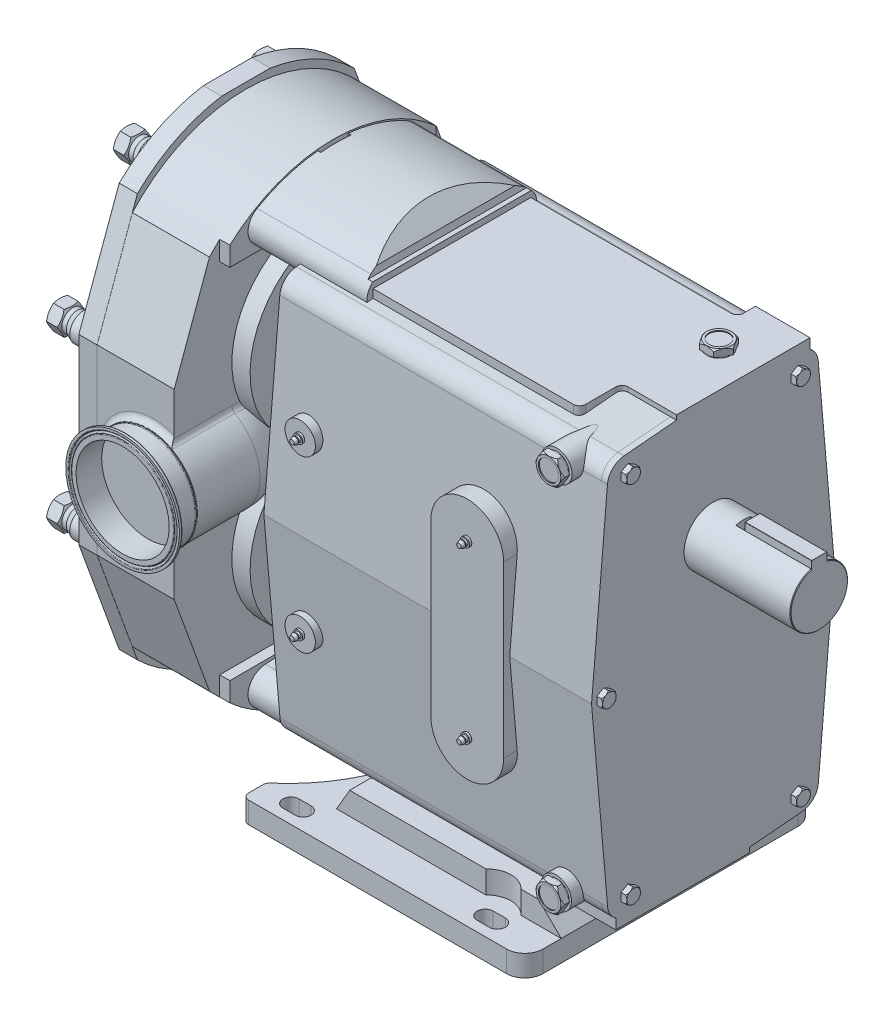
SolidWorks part; units mm, degrees
ref_plane "Front Plane" through (0, 0, 0) normal (0, 0, 1) x (1, 0, 0)
ref_plane "Top Plane" through (0, 0, 0) normal (0, 1, 0) x (1, 0, 0)
ref_plane "Right Plane" through (0, 0, 0) normal (1, 0, 0) x (0, 0, -1)
other "Join1"
other "108373<8>@210_U2_Upper Shaft"
other "108373<4>@210_U2_Upper Shaft"
other "108373<3>@210_U2_Upper Shaft"
other "108373<7>@210_U2_Upper Shaft"
other "108373<6>@210_U2_Upper Shaft"
other "grease fitting<4>@210_U2_Upper Shaft"
other "grease fitting<2>@210_U2_Upper Shaft"
other "cleanout plug<2>@210_U2_Upper Shaft"
other "oil plug<6>@210_U2_Upper Shaft"
other "oil plug<4>@210_U2_Upper Shaft"
other "108373<2>@210_U2_Upper Shaft"
other "Key_320<1>@210_U2_Upper Shaft"
other "Shaft_210<1>@210_U2_Upper Shaft"
other "new cover_gearcase_40669<1>@210_U2_Upper Shaft"
other "grease fitting<3>@210_U2_Upper Shaft"
other "grease fitting<1>@210_U2_Upper Shaft"
other "cleanout plug<1>@210_U2_Upper Shaft"
other "oil plug<5>@210_U2_Upper Shaft"
other "oil plug<3>@210_U2_Upper Shaft"
other "oil plug<2>@210_U2_Upper Shaft"
other "oil plug<1>@210_U2_Upper Shaft"
other "108373<5>@210_U2_Upper Shaft"
other "108373<1>@210_U2_Upper Shaft"
other "105406<1>@210_U2_Upper Shaft"
other "117523<1>@210_U2_Upper Shaft"
other "40288<1>@210_U2_Upper Shaft"
other "105478<1>@210_U2_Upper Shaft"
other "body_shim-210-320-370U2<2>@210_U2_Upper Shaft"
other "body_shim-210-320-370U2<1>@210_U2_Upper Shaft"
other "220360009<2>@210_U2_Upper Shaft"
other "220360009<1>@210_U2_Upper Shaft"
